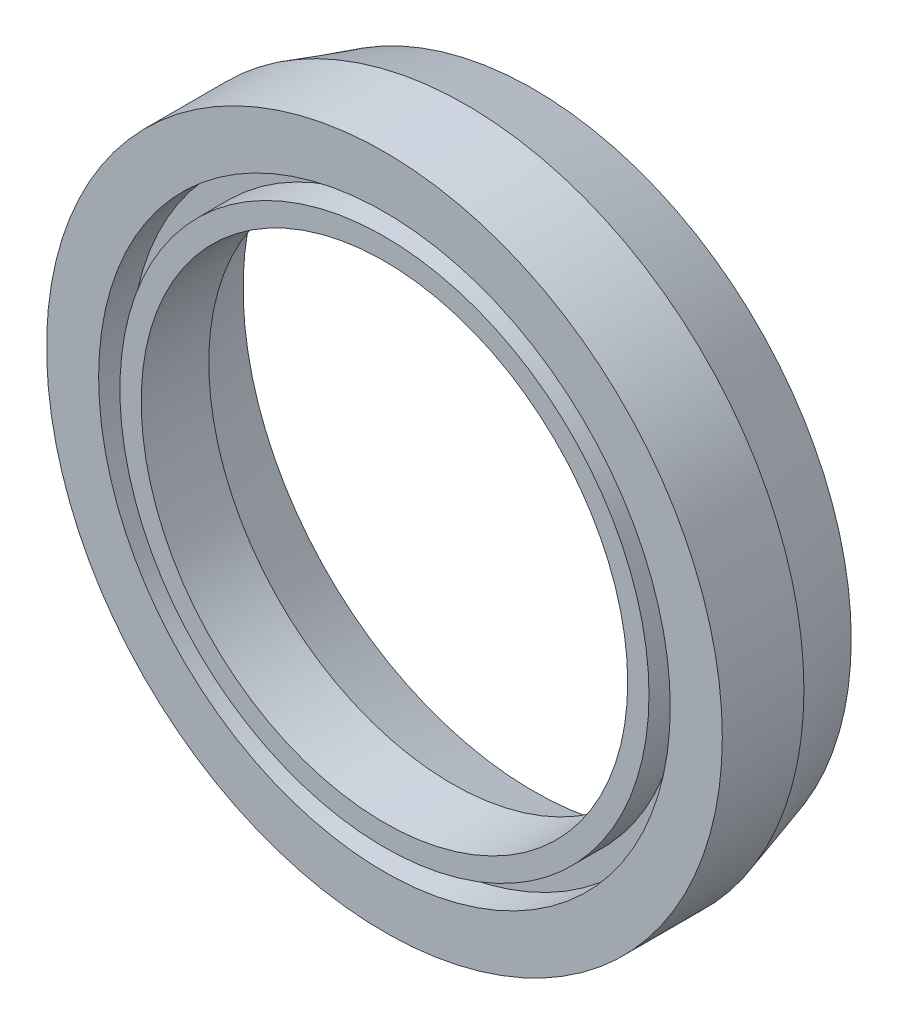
SolidWorks part; units mm, degrees
ref_plane "Front Plane" through (0, 0, 0) normal (0, 0, 1) x (1, 0, 0)
ref_plane "Top Plane" through (0, 0, 0) normal (0, 1, 0) x (1, 0, 0)
ref_plane "Right Plane" through (0, 0, 0) normal (1, 0, 0) x (0, 0, -1)
sketch "Sketch1" plane through (0, 0, 0) normal (0, 0, 1) x (1, 0, 0)
  circle A0 centre (0, 0) radius 15.875
  circle A1 centre (0, 0) radius 11.43
  dimension "D1" = 31.75
  dimension "D2" = 22.86
extrude "Boss-Extrude1" add sketch "Sketch1" along normal blind 3.175
sketch "Sketch2" plane through (0, 0, 0) normal (0, 1, 0) x (1, 0, 0)
  line L0 (-14.9225, 3.8354) -> (-15.875, 0.6604)
  line L1 (-15.875, 0.6604) -> (-15.875, 0)
  line L2 (-14.9225, 3.8354) -> (-14.9225, 0.0254)
  line L3 (-14.9225, 0.0254) -> (-13.6525, 0.0254)
  line L4 (-13.6525, 0.0254) -> (-13.6525, 3.8354)
  line L5 (-13.6525, 3.8354) -> (-12.7, 0.6604)
  line L6 (-12.7, 0.6604) -> (-12.7, 0)
  line L7 (15.875, 0) -> (-15.875, 0) construction
  line L8 (-14.2875, 5.059) -> (-14.2875, -7.1352) construction
  line L9 (-12.7, 0) -> (-15.875, 0)
  dimension "D1" = 1.27
  dimension "D2" = 3.8354
  dimension "D3" = 3.175
  dimension "D4" = 3.81
  dimension "D5" = 3.175
ref_axis "Axis1" through (0, 0, 3.175) along (0, 0, -1)
revolve "Revolve1" add sketch "Sketch2" angle 360 about axis through (0, 0, 3.175) along (0, 0, -1)
sketch "Sketch3" plane through (0, 0, 3.175) normal (0, 0, 1) x (1, 0, 0)
  line L0 (0, 17.1088) -> (0, -17.2502) construction
  line L1 (-16.8791, 0) -> (16.6316, 0) construction
  circle A0 centre (0, 0) radius 12.43
  circle A1 centre (0, 0) radius 13.43
  circle A2 centre (0, 0) radius 11.43 construction
  dimension "D1" = 1
  dimension "D2" = 1
extrude "Cut-Extrude1" cut sketch "Sketch3" against normal blind 1.5
